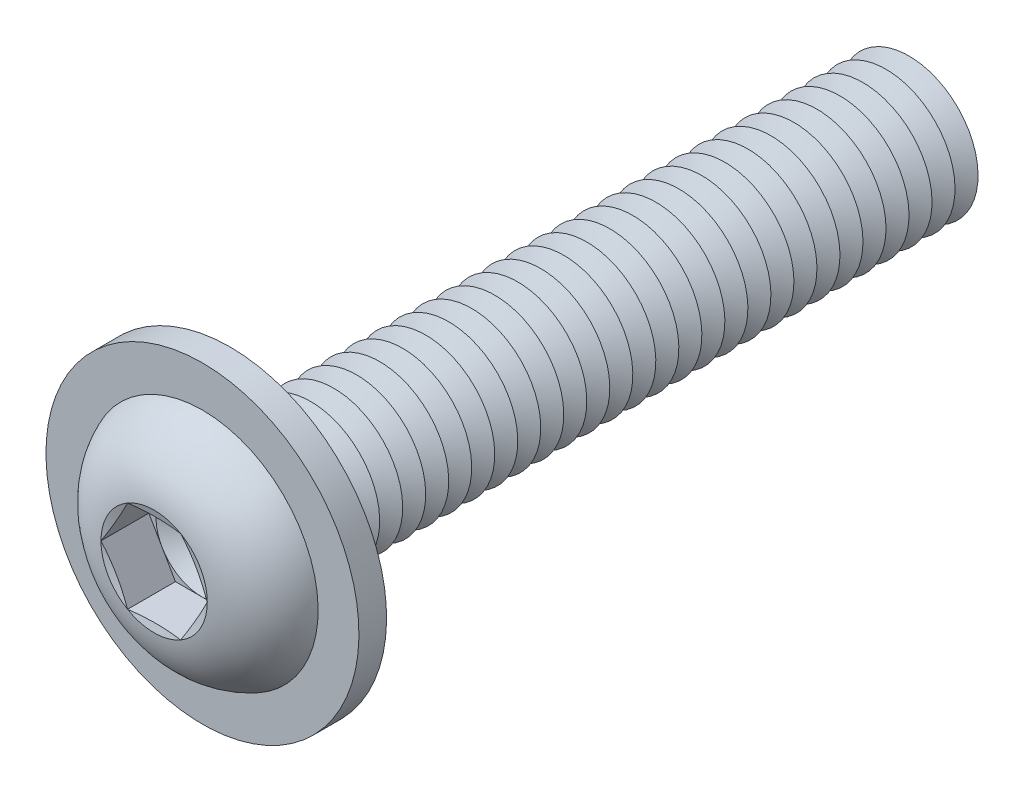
SolidWorks part; units mm, degrees
ref_plane "Front Plane" through (0, 0, 0) normal (0, 0, 1) x (1, 0, 0)
ref_plane "Top Plane" through (0, 0, 0) normal (0, 1, 0) x (1, 0, 0)
ref_plane "Right Plane" through (0, 0, 0) normal (1, 0, 0) x (0, 0, -1)
sketch "Sketch1" plane through (0, 0, 0) normal (1, 0, 0) x (0, 0, -1)
  line L0 (0, 3) -> (0, 5.25)
  line L3 (0, 3) -> (30, 3)
  line L4 (30, 3) -> (30, 0)
  line L5 (30, 0) -> (-3.3, 0) construction
  line L6 (-3.3, 0) -> (30, 0)
  line L7 (-3.3, 2.3094) -> (-3.3, 1.1547) construction
  line L8 (-3.3, 1.1547) -> (-3.3, 0)
  line L9 (-3.3, 2.3094) -> (-2.9906, 1.1547)
  line L10 (-2.9906, 1.1547) -> (-3.3, 1.1547)
  line L11 (30, 0) -> (22.7481, 0) construction
  line L12 (0, 5.25) -> (-3.3, 5.25) construction
  arc A1 (0, 5.25) -> (-3.3, 2.3094) centre (0, 1.928) ccw
  point P8 (30, 1.5)
  dimension "D1" = 10.5
  dimension "D2" = 6
  dimension "D3" = 3.3
  dimension "D4" = 4.6188
  dimension "D5" = 30
  dimension "D6" = 15
revolve "Revolve1" add sketch "Sketch1" angle 360 about L5
fillet "Fillet1" radius 0.5 1 edges at (0, 3, 0)
sketch "Sketch2" plane through (0, 0, 0) normal (1, 0, 0) x (0, 0, -1)
  line L0 (29.5, 3) -> (30.5, 3)
  line L1 (30, 3) -> (0.5, 3) construction
  line L2 (30.5, 3) -> (30, 2.134)
  line L3 (30, -3) -> (30, 3) construction
  line L4 (30, 2.134) -> (29.5, 3)
  dimension "D1" = 1
revolve "Cut-Revolve1" cut sketch "Sketch2" angle 360 about axis through (0, 0, -30) along (0, 0, -1)
pattern_linear "LPattern1" count 30 spacing 1 along (0, 0, 1) of "Cut-Revolve1"
sketch "Sketch3" plane through (0, 0, 3.3) normal (0, 0, 1) x (1, 0, 0)
  line L7 (1.1547, 2) -> (-1.1547, 2)
  line L8 (-1.1547, 2) -> (-2.3094, 0)
  line L9 (-2.3094, 0) -> (-1.1547, -2)
  line L10 (-1.1547, -2) -> (1.1547, -2)
  line L11 (1.1547, -2) -> (2.3094, 0)
  line L12 (2.3094, 0) -> (1.1547, 2)
  circle A0 centre (0, 0) radius 2 construction
  circle A3 centre (0, 0) radius 2.3094 construction
extrude "Cut-Extrude1" cut sketch "Sketch3" against normal blind 2.08
sketch "Sketch4" plane through (0, 0, 1.22) normal (0, 0, 1) x (1, 0, 0)
  line L1 (1.1547, 2) -> (-1.1547, 2) construction
  circle A0 centre (0, 0) radius 2
extrude "Cut-Extrude2" cut sketch "Sketch4" against normal through all draft 60
sketch "Sketch5" plane through (0, 0, 0) normal (0, 0, -1) x (-1, 0, 0)
  circle A0 centre (0, 0) radius 6.8
  circle A1 centre (0, 0) radius 3.5
  circle A2 centre (0, 0) radius 3.5 construction
  dimension "D1" = 13.6
extrude "Boss-Extrude1" add sketch "Sketch5" against normal blind 1.2
